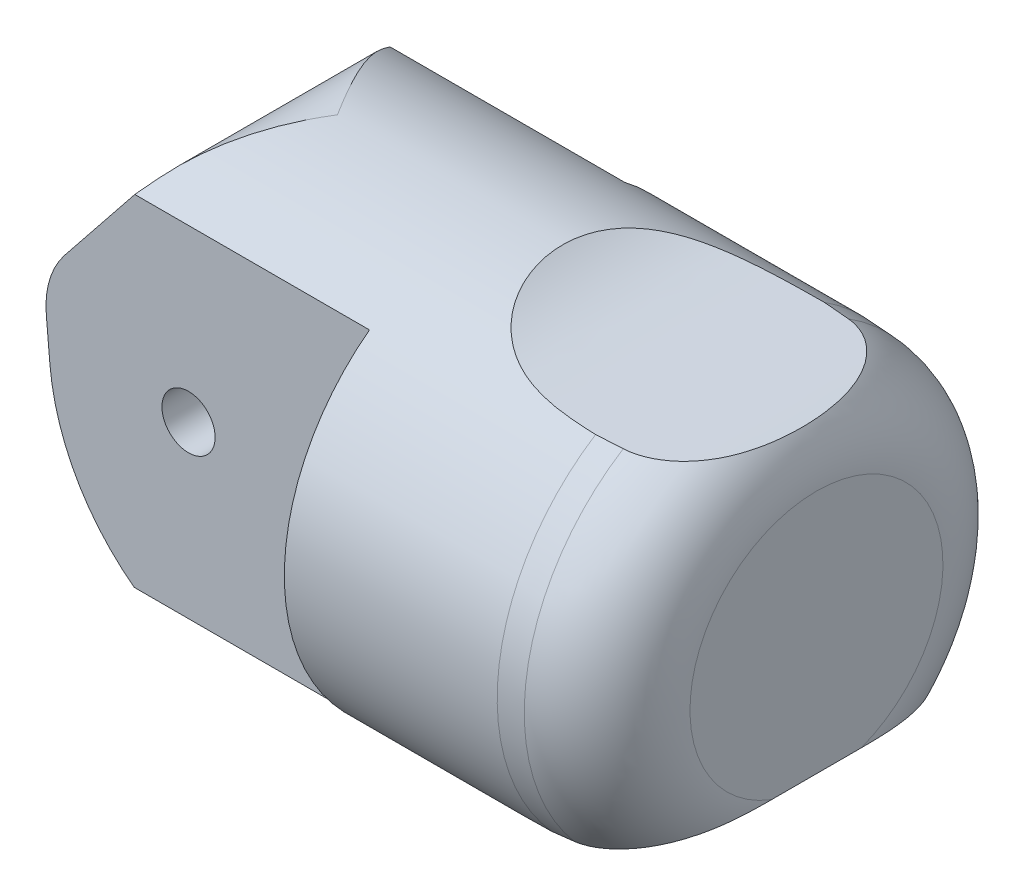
SolidWorks part; units mm, degrees
ref_plane "Plan de face" through (0, 0, 0) normal (0, 0, 1) x (1, 0, 0)
ref_plane "Plan de dessus" through (0, 0, 0) normal (0, 1, 0) x (1, 0, 0)
ref_plane "Plan de droite" through (0, 0, 0) normal (1, 0, 0) x (0, 0, -1)
sketch "Esquisse1" plane through (0, 0, 0) normal (1, 0, 0) x (0, 0, -1)
  circle A0 centre (0, 0) radius 10
  dimension "D1" = 20
extrude "Boss.-Extru.1" add sketch "Esquisse1" against normal blind 26
sketch "Esquisse3" plane through (0, 0, 0) normal (0, 1, 0) x (1, 0, 0)
  line L0 (-26, 0) -> (-26, -6)
  line L2 (0, 0) -> (-26, 0) construction
  line L7 (-26, 10) -> (-26, -10) construction
  line L8 (-26, -10) -> (0, -10) construction
  line L9 (-26, -10) -> (-10, -10)
  line L10 (-26, -10) -> (-26, -6)
  line L11 (-26, 6) -> (-10, 6)
  line L12 (-10, -10) -> (-10, -6)
  line L13 (-10, 10) -> (-10, 6)
  line L14 (-26, -6) -> (-10, -6)
  line L15 (-26, 10) -> (-26, 6)
  line L16 (-26, 10) -> (-10, 10)
  dimension "D4" = 16
  dimension "D5" = 12
extrude "Enlèv. mat.-Extru.1" cut sketch "Esquisse3" against normal through all and the other way through all contours L10 L9 L12 L14 | L15 L11 L13 L16
sketch "Esquisse4" plane through (0, 0, 0) normal (0, 0, 1) x (1, 0, 0)
  line L0 (0, 0) -> (-26, 0) construction
  line L1 (-26, 8) -> (-26, -8) construction
  circle A0 centre (-18.5, 0) radius 1.25
  dimension "D1" = 2.5
  dimension "D2" = 7.5
extrude "Enlèv. mat.-Extru.2" cut sketch "Esquisse4" against normal through all and the other way through all
sketch "Esquisse5" plane through (0, 0, 0) normal (0, 0, 1) x (1, 0, 0)
  line L0 (-25.7147, 6.7385) -> (-25.0489, -0.8716)
  line L1 (-26, -10) -> (0, -10) construction
  line L2 (-15.0869, -10) -> (0, -10)
  line L3 (0, -10) -> (0, 10)
  line L4 (0, 10) -> (-22.7261, 10)
  line L5 (-26, 8) -> (-26, -8) construction
  arc A0 (-15.0869, -10) -> (-25.0489, -0.8716) centre (-15.0869, 0) cw
  arc A1 (-22.7261, 10) -> (-25.7147, 6.7385) centre (-22.7261, 7) ccw
  point P13 (-24.2502, -10)
  point P16 (-26, 10)
  dimension "D2" = 10
  dimension "D3" = 3
  dimension "D1" = 5
extrude "Enlèv. mat.-Extru.3" cut sketch "Esquisse5" against normal through all and the other way through all flip side to cut
sketch "Esquisse6" plane through (0, 0, 0) normal (1, 0, 0) x (0, 0, -1)
  circle A0 centre (0, 0) radius 10
  circle A1 centre (0, 0) radius 10 construction
extrude "Boss.-Extru.2" add sketch "Esquisse6" along normal blind 5 draft 3
sketch "Esquisse7" plane through (0, 0, 0) normal (0, 0, 1) x (1, 0, 0)
  line L0 (0, 10) -> (-17.5013, 10) construction
  line L1 (5, -9.738) -> (5, 9.738) construction
  line L2 (5, -5.5567) -> (-14.9606, -10)
  line L3 (-15.0535, -10) -> (0, -10) construction
  line L4 (-14.9606, -10) -> (-14.9606, -14.4411)
  line L5 (-14.9606, -14.4411) -> (23.4972, -14.4411)
  line L6 (23.4972, -14.4411) -> (23.4972, 12.5649)
  line L7 (23.4972, 12.5649) -> (-6.9249, 12.5649)
  line L8 (-6.9249, 12.5649) -> (-6.9249, 10)
  spline S0 degree 3 poles (-6.9249, 10) (-4.201, 8.1149) (4.734, 9.2631) (13.2635, 6.1095) (5, -5.5567) knots 0 0 0 0 0.368014 1 1 1 1
  point P15 (1.6943, 7.3597)
  point P17 (-3.3158, 9.0037)
  point P18 (-4.8814, 9.0037)
  point P19 (5, 6.6552)
  point P20 (0, 0)
  point P21 (0, 0)
  point P22 (2.3205, 8.3774)
  point P23 (5, 8.0643)
  point P24 (5, -5.5567)
extrude "Enlèv. mat.-Extru.4" cut sketch "Esquisse7" against normal through all both and the other way through all
fillet "Congé1" radius 4 2 edges at (5, 1.7841, 9.5731) (5, 1.7841, -9.5731)
sketch "Esquisse10" plane through (-24.9011, -2.1786, 0) normal (-0.9962, -0.0872, 0) x (0, 0, 1)
  line L1 (-3, 8.9541) -> (3, 8.9541)
  line L2 (-3, 8.9541) -> (-3, -5.0459)
  line L3 (-3, -5.0459) -> (3, -5.0459)
  line L4 (3, 8.9541) -> (3, -5.0459)
  line L5 (-6, 3.2202) -> (-6, 1.312) construction
  line L6 (6, 3.2202) -> (6, 1.312) construction
  point P10 (0, 8.9541)
  dimension "D1" = 3
  dimension "D2" = 3
  dimension "D3" = 14
extrude "Enlèv. mat.-Extru.6" cut sketch "Esquisse10" against normal blind 12
shell "Coque2" thickness 4
sketch "Esquisse11" plane through (1.4146, -6.3548, 0) normal (0.2173, -0.9761, 0) x (0.9761, 0.2173, 0)
  line L0 (-16.776, 0) -> (3.6732, 0) construction
  line L1 (3.6732, -2.1051) -> (3.6732, 2.1051) construction
  circle A0 centre (-4.6071, 0) radius 8 construction
  ellipse E0 centre (29.2466, 0) end of major axis (-16.776, 0) minor radius 10 (-1.4492, 7.4508) -> (-1.4492, -7.4508) ccw construction
  point P13 (-3.3381, 0)
  point P14 (-4.6071, 0)
  dimension "D1" = 16
